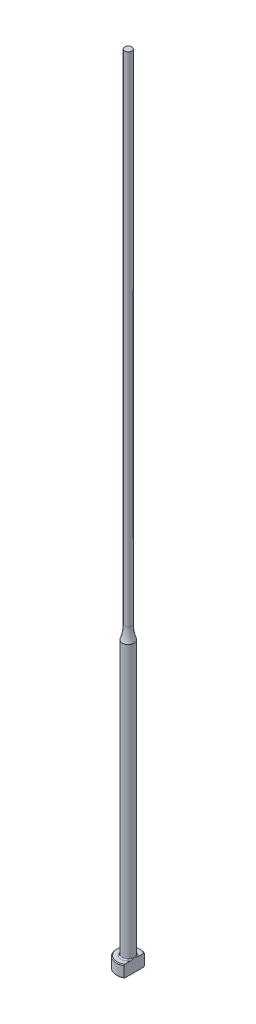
SolidWorks part; units mm, degrees
ref_plane "Front Plane" through (0, 0, 0) normal (0, 0, 1) x (1, 0, 0)
ref_plane "Top Plane" through (0, 0, 0) normal (0, 1, 0) x (1, 0, 0)
ref_plane "Right Plane" through (0, 0, 0) normal (1, 0, 0) x (0, 0, -1)
sketch "Sketch1" plane through (0, 0, 0) normal (0, 0, 1) x (1, 0, 0)
  line L0 (0, 259.9588) -> (0, -15.1925) construction
  line L1 (0, 0) -> (-3, 0)
  line L2 (-3, 0) -> (-3, 3)
  line L3 (-3, 3) -> (-1.5, 3)
  line L4 (-0.9, 75) -> (-0.9, 200)
  line L5 (-0.9, 200) -> (0, 200)
  line L6 (0, 200) -> (0, 0)
  line L7 (-1.5, 3) -> (-1.5, 71.5883)
  arc A0 (-1.5, 71.5883) -> (-0.9, 75) centre (-10.9, 75) ccw
  point P13 (-1.5, 0)
  dimension "D1" = 10
  dimension "L" = 200
  dimension "H" = 6
  dimension "T" = 3
  dimension "D" = 1.8
  dimension "B" = 3
  dimension "S" = 75
revolve "Revolve1" add sketch "Sketch1" angle 360 about L0
chamfer "Chamfer1" distance 0.2 angle 45 2 edges at (0, 3, 3) (0, 0, 3)
fillet "Fillet1" radius 0.3 1 edges at (0, 3, 1.5)
sketch "Sketch2" plane through (0, 0, 0) normal (0, 1, 0) x (1, 0, 0)
  line L0 (1.5, 2.5981) -> (1.5, -2.5981)
  circle A0 centre (0, 0) radius 3 construction
  arc A1 (1.5, -2.5981) -> (1.5, 2.5981) centre (0, 0) ccw
  circle A2 centre (0, 0) radius 1.5 construction
extrude "KEY" cut sketch "Sketch2" along normal through all
